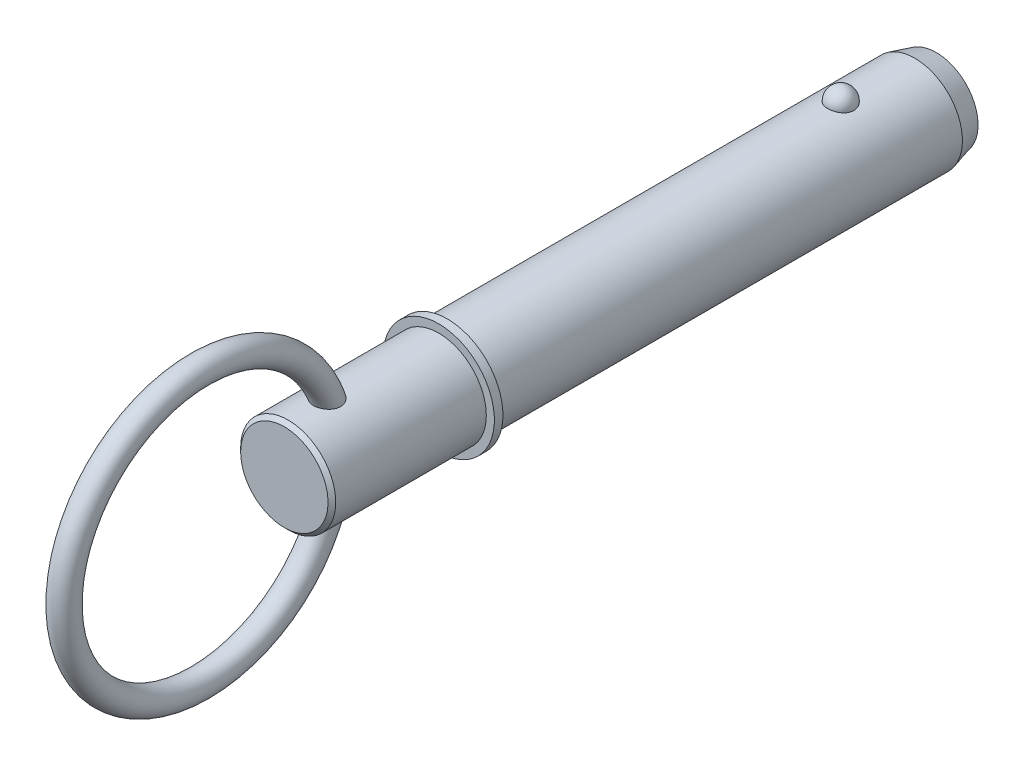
SolidWorks part; units mm, degrees
ref_plane "Front Plane" through (0, 0, 0) normal (0, 0, 1) x (1, 0, 0)
ref_plane "Top Plane" through (0, 0, 0) normal (0, 1, 0) x (1, 0, 0)
ref_plane "Right Plane" through (0, 0, 0) normal (1, 0, 0) x (0, 0, -1)
sketch "Sketch2" plane through (0, 0, 0) normal (0, 0, 1) x (1, 0, 0)
  circle A0 centre (0, 0) radius 11.115
  point P3 (0, 11.115)
  dimension "D1" = 22.23
extrude "Boss-Extrude1" add sketch "Sketch2" along normal blind 88.9
sketch "Sketch3" plane through (0, 0, 0) normal (0, 0, -1) x (-1, 0, 0)
  circle A0 centre (0, 0) radius 11.115
  dimension "D1" = 22.23
extrude "Boss-Extrude2" add sketch "Sketch3" along normal blind 25.4
chamfer "Chamfer1" distance 5 angle 15 1 edges at (-11.115, 0, -25.4)
sketch "Sketch18" plane through (0, 0, 0) normal (1, 0, 0) x (0, 0, -1)
  line L0 (20.4, 11.115) -> (-88.9, 11.115) construction
  line L1 (3.07, 14.185) -> (3.07, 8.045)
  line L2 (-88.9, -11.115) -> (20.4, -11.115) construction
  arc A0 (3.07, 14.185) -> (3.07, 8.045) centre (3.07, 11.115) ccw
  point P4 (0, 11.115)
  dimension "D1" = 25.3
revolve "Revolve1" add sketch "Sketch18" angle 360 about L1
sketch "Sketch19" plane through (0, 0, 0) normal (1, 0, 0) x (0, 0, -1)
  line L0 (-33.7288, 0) -> (-46.4542, 0) construction
sketch "Sketch20" plane through (0, 0, 0) normal (1, 0, 0) x (0, 0, -1)
  line L0 (-88.9, 0) -> (-88.9, 13)
  line L1 (-88.9, 11.115) -> (-88.9, -11.115) construction
  line L2 (-88.9, 13) -> (-90.9, 13)
  line L3 (-90.9, 13) -> (-90.9, 0)
  line L4 (-33.7288, 0) -> (-46.4542, 0) construction
  line L5 (-90.9, 0) -> (-88.9, 0)
  dimension "D1" = 13
  dimension "D2" = 2
revolve "Revolve2" add sketch "Sketch20" angle 360 about L0
sketch "Sketch21" plane through (0, 0, 88.9) normal (0, 0, -1) x (-1, 0, 0)
  circle A0 centre (0, 0) radius 11.115
  dimension "D1" = 22.23
extrude "Boss-Extrude3" add sketch "Sketch21" against normal blind 38.1
chamfer "Chamfer2" distance 0.9 angle 45 1 edges at (-11.115, 0, 127)
sketch "Sketch23" plane through (0, 0, 0) normal (1, 0, 0) x (0, 0, -1)
  line L0 (-127, 10.215) -> (-127, -10.215) construction
  circle A0 centre (-146.75, 0) radius 31.75
  point P2 (-115, 0)
  dimension "D1" = 63.5
  dimension "D2" = 12
sketch "Sketch24" plane through (0, 0, 0) normal (0, 1, 0) x (1, 0, 0)
  circle A0 centre (0, -115) radius 3
  dimension "D1" = 6
sweep "Sweep1" add profiles "Sketch24" path "Sketch23"
